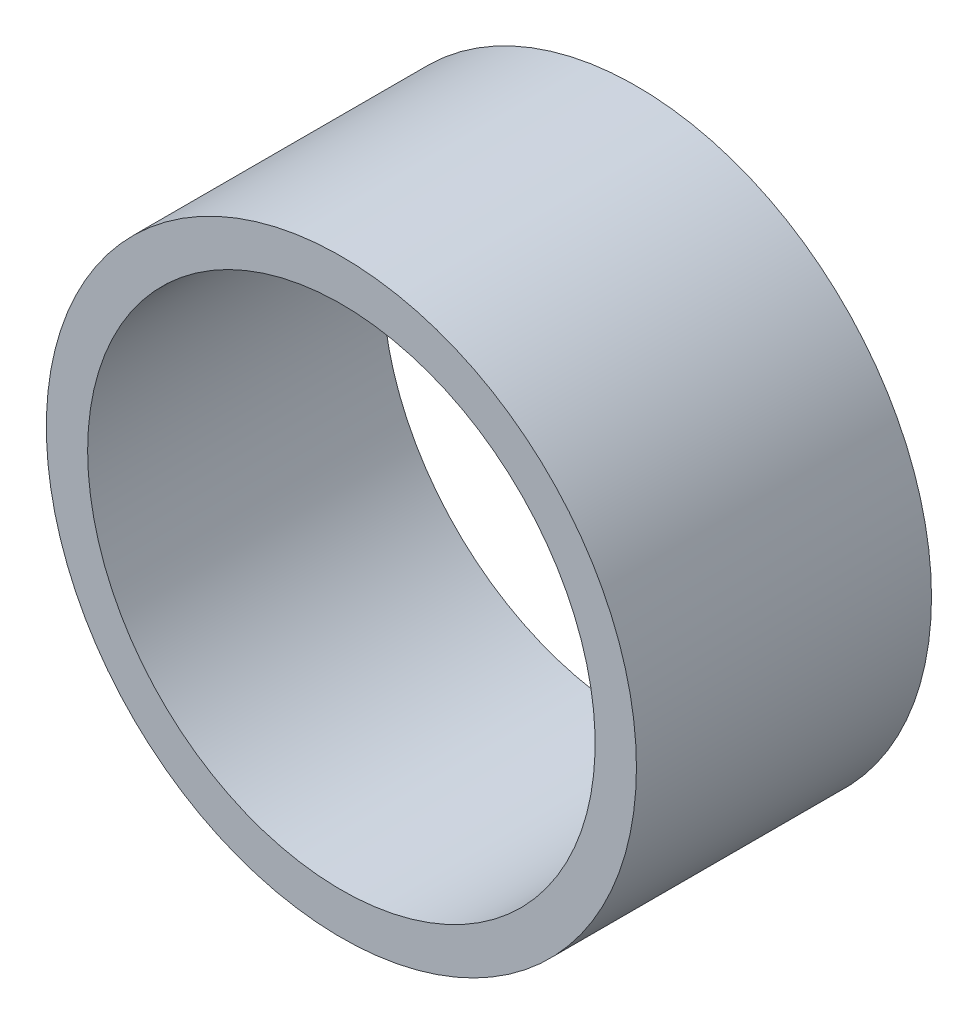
SolidWorks part; units mm, degrees
ref_plane "Front Plane" through (0, 0, 0) normal (0, 0, 1) x (1, 0, 0)
ref_plane "Top Plane" through (0, 0, 0) normal (0, 1, 0) x (1, 0, 0)
ref_plane "Right Plane" through (0, 0, 0) normal (1, 0, 0) x (0, 0, -1)
sketch "Sketch1" plane through (0, 0, 0) normal (0, 0, 1) x (1, 0, 0)
  circle A0 centre (0, 0) radius 6.35
  dimension "D1" = 12.7
extrude "Base-Extrude" add sketch "Sketch1" along normal blind 6.35
sketch "Sketch3" plane through (0, 0, 0) normal (0, 0, -1) x (-1, 0, 0)
  circle A0 centre (0, 0) radius 5.461
  circle A1 centre (0, 0) radius 6.35 construction
  dimension "D1" = 10.922
extrude "Cut-Extrude1" cut sketch "Sketch3" against normal through all
